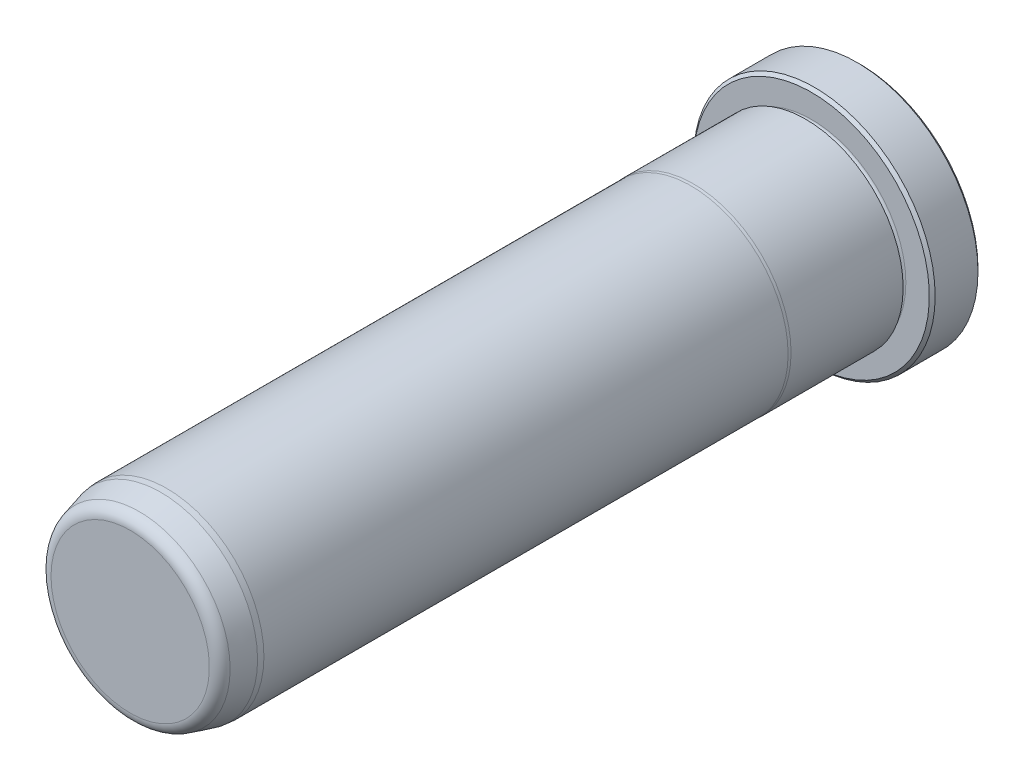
SolidWorks part; units mm, degrees
ref_plane "Front Plane" through (0, 0, 0) normal (0, 0, 1) x (1, 0, 0)
ref_plane "Top Plane" through (0, 0, 0) normal (0, 1, 0) x (1, 0, 0)
ref_plane "Right Plane" through (0, 0, 0) normal (1, 0, 0) x (0, 0, -1)
sketch "Sketch1" plane through (0, 0, 0) normal (1, 0, 0) x (0, 0, -1)
  line L0 (0, 0) -> (0, 15.748)
  line L1 (0, 15.748) -> (-6.35, 15.748)
  line L2 (-6.35, 15.748) -> (-6.35, 12.3063)
  line L3 (-6.35, 11.9253) -> (-7.112, 11.9253) construction
  line L4 (-7.112, 12.3063) -> (-7.112, 12.7127)
  line L5 (-7.112, 12.7127) -> (-21.7348, 12.7127)
  line L6 (-21.7348, 12.7127) -> (-22.098, 12.6873)
  line L7 (-22.098, 12.6873) -> (-90.4875, 12.6873)
  line L9 (-95.25, 11.5487) -> (-95.25, 0)
  line L10 (-95.25, 0) -> (0, 0)
  line L11 (0, 0) -> (13.6287, 0) construction
  line L12 (-90.4875, 12.6873) -> (-91.2495, 12.6206)
  line L13 (-91.2495, 12.6206) -> (-95.25, 11.5487)
  arc A0 (-7.112, 12.3063) -> (-6.35, 12.3063) centre (-6.731, 12.3063) ccw
  dimension "D14" = 0.762
  dimension "D1" = 6.35
  dimension "D2" = 0.762
  dimension "D3" = 31.496
  dimension "D4" = 25.4254
  dimension "D5" = 22.098
  dimension "D6" = 95.25
  dimension "D7" = 0.7874
  dimension "D8" = 4
  dimension "D9" = 25.3746
  dimension "D10" = 5
  dimension "D11" = 15
  dimension "D12" = 0.762
  dimension "D13" = 4.7625
revolve "Revolve1" add sketch "Sketch1" angle 360 about L11
fillet "Fillet6" radius 1.5875 1 edges at (11.5487, 0, 95.25)
chamfer "Chamfer1" distance 0.381 angle 45 2 edges at (15.748, 0, 0) (15.748, 0, 6.35)
